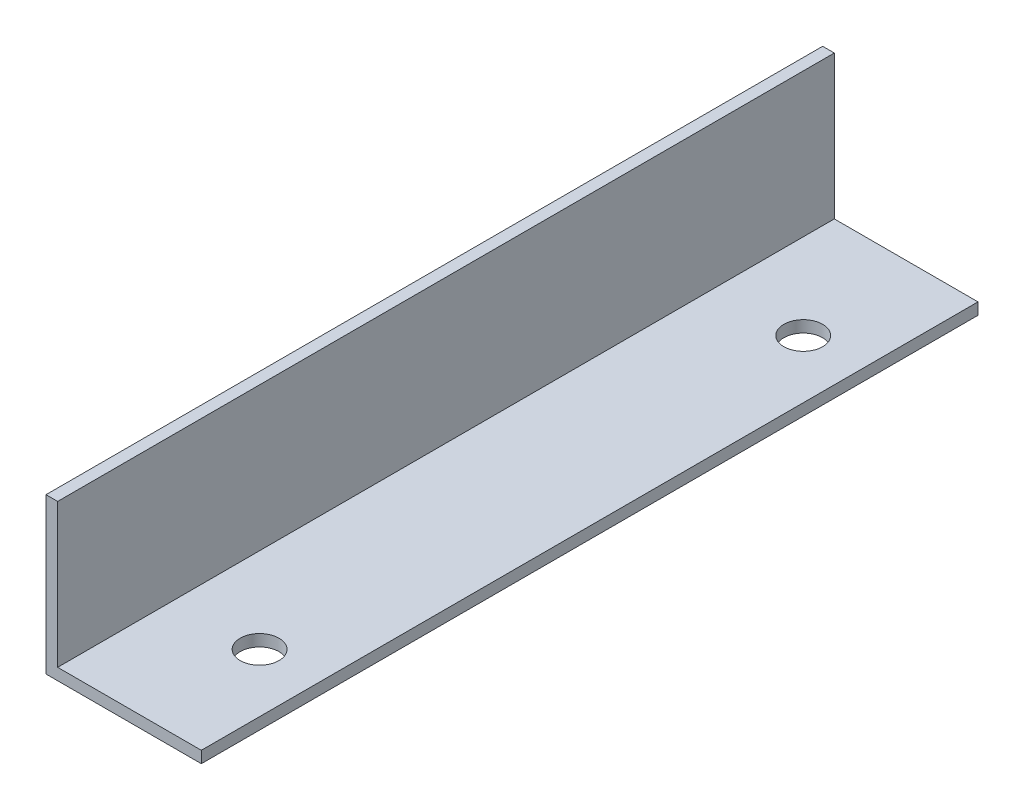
SolidWorks part; units mm, degrees
ref_plane "Plan1" through (0, 0, 0) normal (0, 0, 1) x (1, 0, 0)
ref_plane "Plan2" through (0, 0, 0) normal (0, 1, 0) x (1, 0, 0)
ref_plane "Plan3" through (0, 0, 0) normal (1, 0, 0) x (0, 0, -1)
sketch "Esquisse1" plane through (0, 0, 0) normal (0, 0, 1) x (1, 0, 0)
  line L0 (0, 0) -> (0, 40)
  line L1 (0, 40) -> (3, 40)
  line L2 (3, 40) -> (3, 3)
  line L3 (3, 3) -> (40, 3)
  line L4 (40, 3) -> (40, 0)
  line L5 (40, 0) -> (0, 0)
  dimension "D1" = 40
  dimension "D2" = 40
  dimension "D3" = 3
  dimension "D4" = 3
extrude "Extrusion1" add sketch "Esquisse1" along normal blind 200
sketch "Esquisse2" plane through (0, 3, 0) normal (0, 1, 0) x (-1, 0, 0)
  line L0 (-40, 200) -> (-40, 0) construction
  line L1 (-40, 200) -> (-40, 0) construction
  line L2 (-40, 0) -> (-3, 0) construction
  line L3 (-40, 200) -> (-3, 200) construction
  circle A0 centre (-25, 170) radius 5
  circle A1 centre (-25, 30) radius 5
  dimension "D1" = 10
  dimension "D2" = 10
  dimension "D3" = 15
  dimension "D4" = 15
  dimension "D5" = 30
  dimension "D6" = 30
extrude "Enlèv. mat.-Extru.1" cut sketch "Esquisse2" against normal through all
